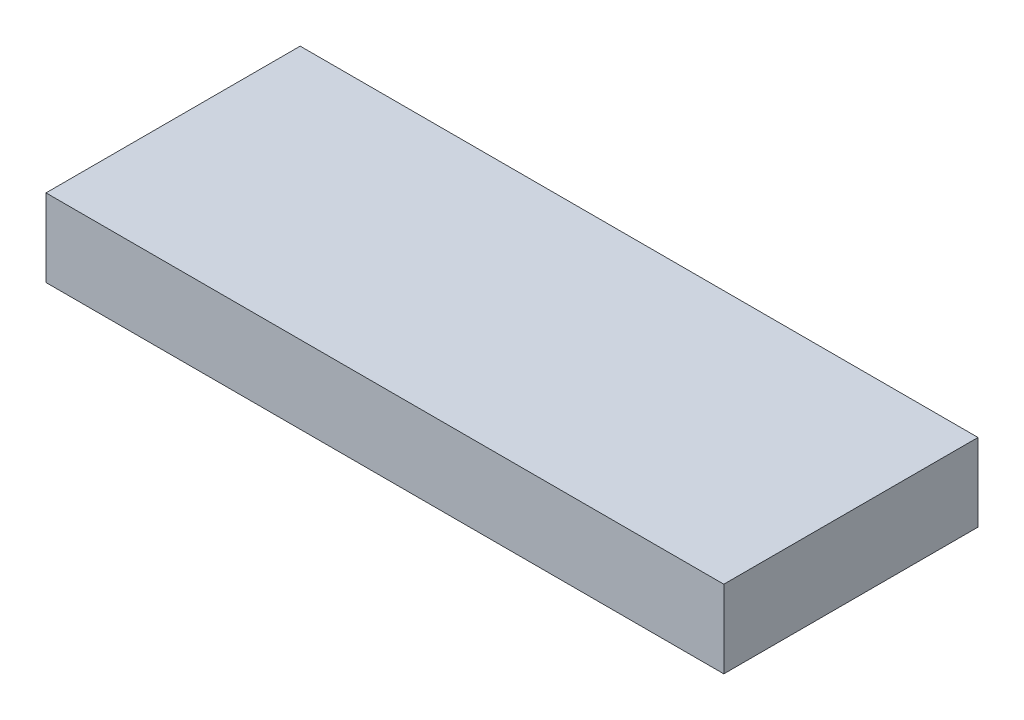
SolidWorks part; units mm, degrees
ref_plane "Front Plane" through (0, 0, 0) normal (0, 0, 1) x (1, 0, 0)
ref_plane "Top Plane" through (0, 0, 0) normal (0, 1, 0) x (1, 0, 0)
ref_plane "Right Plane" through (0, 0, 0) normal (1, 0, 0) x (0, 0, -1)
sketch "Sketch1" plane through (0, 0, 0) normal (0, 0, 1) x (1, 0, 0)
  line L1 (-76.2, -8.7312) -> (76.2, -8.7312)
  line L2 (-76.2, -8.7312) -> (-76.2, 8.7312)
  line L3 (-76.2, 8.7312) -> (76.2, 8.7312)
  line L4 (76.2, -8.7312) -> (76.2, 8.7312)
  line L5 (-76.2, -8.7312) -> (76.2, 8.7312) construction
  line L6 (-76.2, 8.7312) -> (76.2, -8.7312) construction
  point P0 (0, 0)
  dimension "D1" = 17.4625
  dimension "D2" = 152.4
extrude "Boss-Extrude1" add sketch "Sketch1" against normal blind 57.15 contours L3 L4 L1 L2
